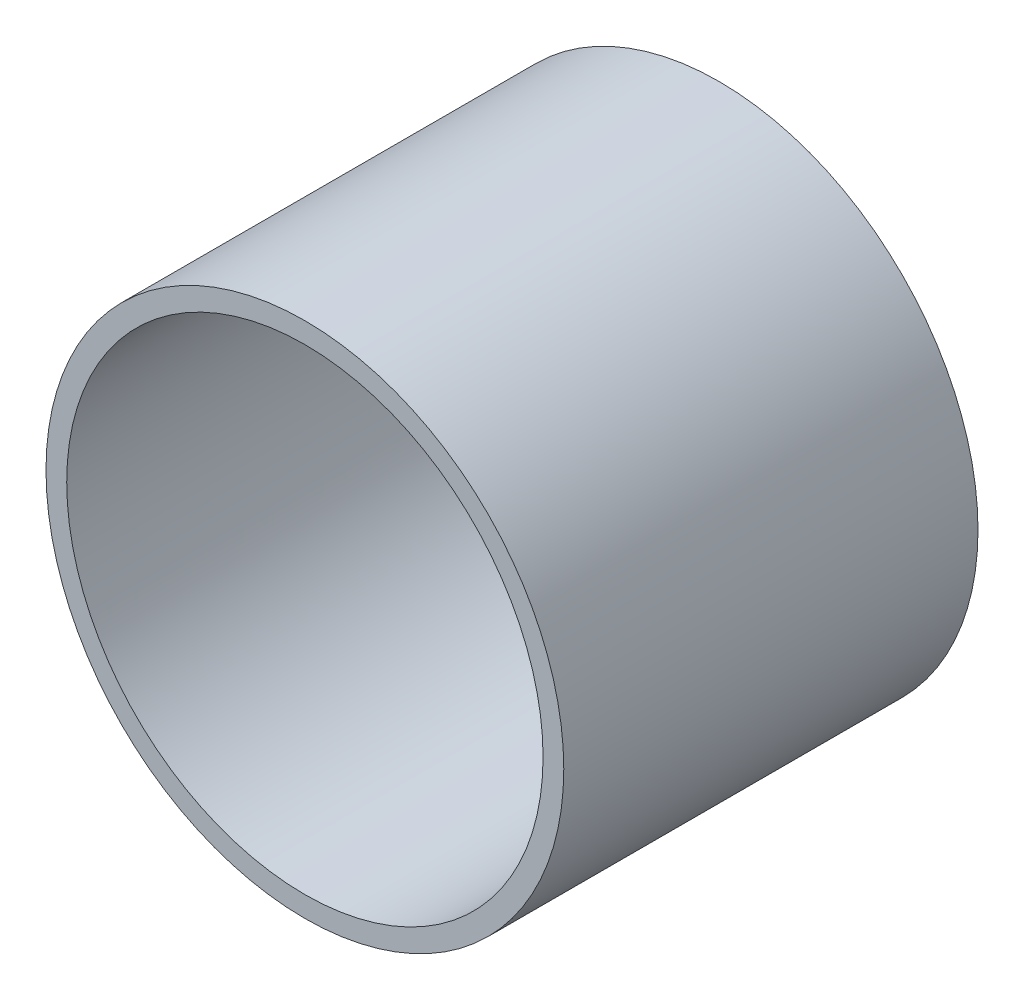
SolidWorks part; units mm, degrees
ref_plane "Front" through (0, 0, 0) normal (0, 0, 1) x (1, 0, 0)
ref_plane "Top" through (0, 0, 0) normal (0, 1, 0) x (1, 0, 0)
ref_plane "Right" through (0, 0, 0) normal (1, 0, 0) x (0, 0, -1)
sketch "Sketch1" plane through (0, 0, 0) normal (0, 0, 1) x (1, 0, 0)
  circle A0 centre (0, 0) radius 3.9688
  dimension "D1" = 7.9375
extrude "Extrude1" add sketch "Sketch1" along normal blind 6.35
shell "Shell1" thickness 0.3175
